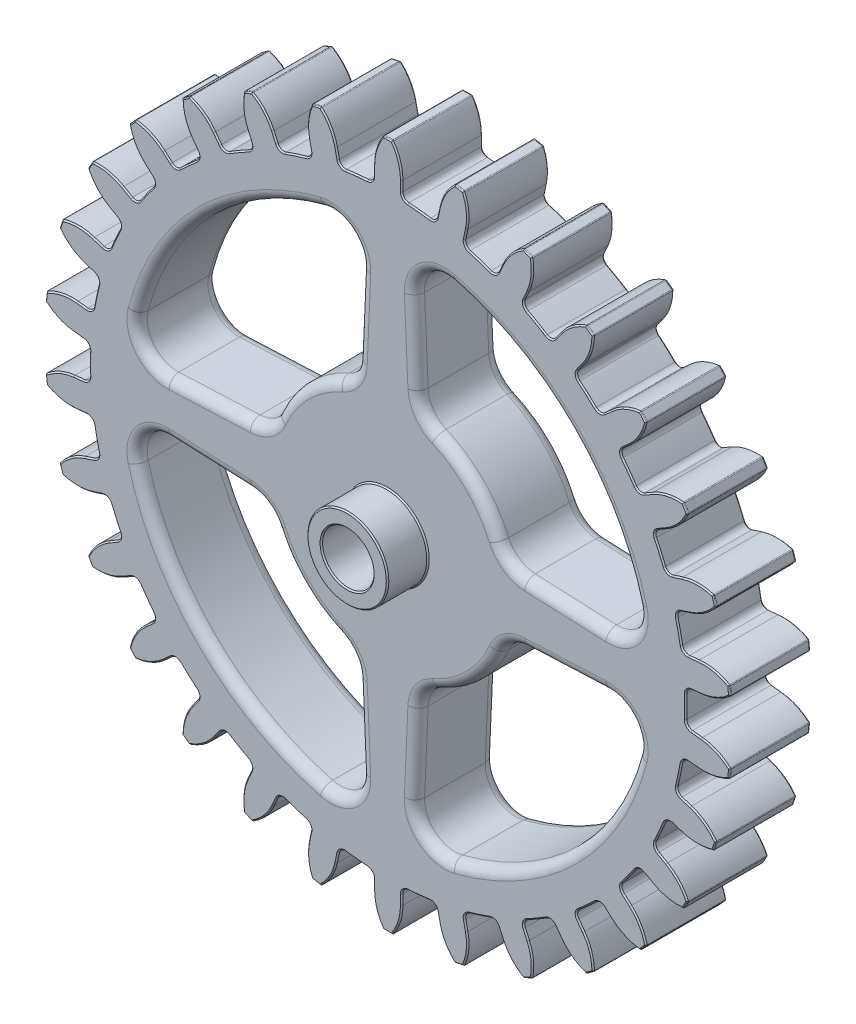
SolidWorks part; units mm, degrees
ref_plane "Спереди" through (0, 0, 0) normal (0, 0, 1) x (1, 0, 0)
ref_plane "Сверху" through (0, 0, 0) normal (0, 1, 0) x (1, 0, 0)
ref_plane "Справа" through (0, 0, 0) normal (1, 0, 0) x (0, 0, -1)
sketch "Эскиз1" plane through (0, 0, 0) normal (0, 0, 1) x (1, 0, 0)
  line L0 (0, 0) -> (0, 68) construction
  line L1 (0, 0) -> (-68, 0) construction
  line L2 (-2.8, 62.1091) -> (-2.8, 60.1324)
  line L3 (2.8, 62.1091) -> (2.8, 60.1324)
  line L4 (10.1744, 61.334) -> (9.7634, 59.4005)
  line L5 (15.652, 60.1697) -> (15.241, 58.2362)
  line L6 (22.7041, 57.8783) -> (21.9001, 56.0726)
  line L7 (27.82, 55.6006) -> (27.016, 53.7948)
  line L8 (34.2415, 51.8931) -> (33.0797, 50.2939)
  line L9 (38.772, 48.6015) -> (37.6102, 47.0024)
  line L10 (44.2825, 43.6399) -> (42.8135, 42.3172)
  line L11 (48.0296, 39.4783) -> (46.5607, 38.1556)
  line L12 (52.388, 33.4794) -> (50.6762, 32.4911)
  line L13 (55.188, 28.6297) -> (53.4762, 27.6413)
  line L14 (58.204, 21.8557) -> (56.3241, 21.2449)
  line L15 (59.9345, 16.5298) -> (58.0546, 15.919)
  line L16 (61.4761, 9.2768) -> (59.5103, 9.0702)
  line L17 (62.0615, 3.7075) -> (60.0957, 3.5009)
  line L18 (62.0615, -3.7075) -> (60.0957, -3.5009)
  line L19 (61.4761, -9.2768) -> (59.5103, -9.0702)
  line L20 (59.9345, -16.5298) -> (58.0546, -15.919)
  line L21 (58.204, -21.8557) -> (56.3241, -21.2449)
  line L22 (55.188, -28.6297) -> (53.4762, -27.6413)
  line L23 (52.388, -33.4794) -> (50.6762, -32.4911)
  line L24 (48.0296, -39.4783) -> (46.5607, -38.1556)
  line L25 (44.2825, -43.6399) -> (42.8135, -42.3172)
  line L26 (38.772, -48.6015) -> (37.6102, -47.0024)
  line L27 (34.2415, -51.8931) -> (33.0797, -50.2939)
  line L28 (27.82, -55.6006) -> (27.016, -53.7948)
  line L29 (22.7041, -57.8783) -> (21.9001, -56.0726)
  line L30 (15.652, -60.1697) -> (15.241, -58.2362)
  line L31 (10.1744, -61.334) -> (9.7634, -59.4005)
  line L32 (2.8, -62.1091) -> (2.8, -60.1324)
  line L33 (-2.8, -62.1091) -> (-2.8, -60.1324)
  line L34 (-10.1744, -61.334) -> (-9.7634, -59.4005)
  line L35 (-15.652, -60.1697) -> (-15.241, -58.2362)
  line L36 (-22.7041, -57.8783) -> (-21.9001, -56.0726)
  line L37 (-27.82, -55.6006) -> (-27.016, -53.7948)
  line L38 (-34.2415, -51.8931) -> (-33.0797, -50.2939)
  line L39 (-38.772, -48.6015) -> (-37.6102, -47.0024)
  line L40 (-44.2825, -43.6399) -> (-42.8135, -42.3172)
  line L41 (-48.0296, -39.4783) -> (-46.5607, -38.1556)
  line L42 (-52.388, -33.4794) -> (-50.6762, -32.4911)
  line L43 (-55.188, -28.6297) -> (-53.4762, -27.6413)
  line L44 (-58.204, -21.8557) -> (-56.3241, -21.2449)
  line L45 (-59.9345, -16.5298) -> (-58.0546, -15.919)
  line L46 (-61.4761, -9.2768) -> (-59.5103, -9.0702)
  line L47 (-62.0615, -3.7075) -> (-60.0957, -3.5009)
  line L48 (-62.0615, 3.7075) -> (-60.0957, 3.5009)
  line L49 (-61.4761, 9.2768) -> (-59.5103, 9.0702)
  line L50 (-59.9345, 16.5298) -> (-58.0546, 15.919)
  line L51 (-58.204, 21.8557) -> (-56.3241, 21.2449)
  line L52 (-55.188, 28.6297) -> (-53.4762, 27.6413)
  line L53 (-52.388, 33.4794) -> (-50.6762, 32.4911)
  line L54 (-48.0296, 39.4783) -> (-46.5607, 38.1556)
  line L55 (-44.2825, 43.6399) -> (-42.8135, 42.3172)
  line L56 (-38.772, 48.6015) -> (-37.6102, 47.0024)
  line L57 (-34.2415, 51.8931) -> (-33.0797, 50.2939)
  line L58 (-27.82, 55.6006) -> (-27.016, 53.7948)
  line L59 (-22.7041, 57.8783) -> (-21.9001, 56.0726)
  line L60 (-15.652, 60.1697) -> (-15.241, 58.2362)
  line L61 (-10.1744, 61.334) -> (-9.7634, 59.4005)
  line L62 (-5.3258, 43.2912) -> (-6.0273, 27.2243)
  line L63 (-43.2912, 5.3258) -> (-27.2243, 6.0273)
  line L64 (-5, 54.4793) -> (-5, 47.9664) construction
  line L65 (5.3258, 43.2912) -> (6.0273, 27.2243)
  line L66 (43.2912, 5.3258) -> (27.2243, 6.0273)
  line L67 (43.2912, -5.3258) -> (27.2243, -6.0273)
  line L68 (5.3258, -43.2912) -> (6.0273, -27.2243)
  line L69 (-5.3258, -43.2912) -> (-6.0273, -27.2243)
  line L70 (-43.2912, -5.3258) -> (-27.2243, -6.0273)
  circle A0 centre (0, 0) radius 5.1
  circle A1 centre (0, 0) radius 8 construction
  arc A2 (0.8848, 67.9942) -> (-0.8848, 67.9942) centre (0, 0) ccw
  arc A3 (-3.9842, 58.8653) -> (-8.3416, 58.4073) centre (0, 0) ccw
  circle A4 centre (0, 0) radius 62.525 construction
  arc A5 (-0.8848, 67.9942) -> (-2.8, 62.1091) centre (7.2, 62.1091) ccw
  arc A6 (0.8848, 67.9942) -> (2.8, 62.1091) centre (-7.2, 62.1091) cw
  arc A7 (2.8, 60.1324) -> (3.9842, 58.8653) centre (4.07, 60.1324) ccw
  arc A8 (-2.8, 60.1324) -> (-3.9842, 58.8653) centre (-4.07, 60.1324) cw
  arc A9 (9.7634, 59.4005) -> (8.3416, 58.4073) centre (8.5212, 59.6646) cw
  arc A10 (13.2713, 66.6924) -> (10.1744, 61.334) centre (19.9559, 59.2549) ccw
  arc A11 (15.0023, 66.3244) -> (13.2713, 66.6924) centre (0, 0) ccw
  arc A12 (15.0023, 66.3244) -> (15.652, 60.1697) centre (5.8705, 62.2488) cw
  arc A13 (15.241, 58.2362) -> (16.136, 56.7506) centre (16.4833, 57.9722) ccw
  arc A14 (21.9001, 56.0726) -> (20.3029, 55.3967) centre (20.7399, 56.5891) cw
  arc A15 (26.8474, 62.4757) -> (22.7041, 57.8783) centre (31.8396, 53.8109) ccw
  arc A16 (28.4641, 61.7559) -> (26.8474, 62.4757) centre (0, 0) ccw
  arc A17 (28.4641, 61.7559) -> (27.82, 55.6006) centre (18.6845, 59.668) cw
  arc A18 (27.016, 53.7948) -> (27.5825, 52.1556) centre (28.1762, 53.2783) ccw
  arc A19 (33.0797, 50.2939) -> (31.3769, 49.9649) centre (32.0523, 51.0404) cw
  arc A20 (39.2502, 55.5286) -> (34.2415, 51.8931) centre (42.3317, 46.0152) ccw
  arc A21 (40.6819, 54.4884) -> (39.2502, 55.5286) centre (0, 0) ccw
  arc A22 (40.6819, 54.4884) -> (38.772, 48.6015) centre (30.6819, 54.4793) cw
  arc A23 (37.6102, 47.0024) -> (37.8235, 45.2812) centre (38.6376, 46.2559) ccw
  arc A24 (42.8135, 42.3172) -> (41.0795, 42.3495) centre (41.9637, 43.261) cw
  arc A25 (49.9375, 46.1546) -> (44.2825, 43.6399) centre (50.9738, 36.2084) ccw
  arc A26 (51.1216, 44.8395) -> (49.9375, 46.1546) centre (0, 0) ccw
  arc A27 (51.1216, 44.8395) -> (48.0296, 39.4783) centre (41.3383, 46.9097) cw
  arc A28 (46.5607, 38.1556) -> (46.4114, 36.4277) centre (47.4105, 37.2118) ccw
  arc A29 (50.6762, 32.4911) -> (48.9867, 32.8831) centre (50.0412, 33.5909) cw
  arc A30 (58.4423, 34.7634) -> (52.388, 33.4794) centre (57.388, 24.8191) ccw
  arc A31 (59.3272, 33.2308) -> (58.4423, 34.7634) centre (0, 0) ccw
  arc A32 (59.3272, 33.2308) -> (55.188, 28.6297) centre (50.188, 37.2899) cw
  arc A33 (53.4762, 27.6413) -> (52.971, 25.9822) centre (54.1112, 26.5415) ccw
  arc A34 (56.3241, 21.2449) -> (54.753, 21.9796) centre (55.9316, 22.4527) cw
  arc A35 (64.3929, 21.8529) -> (58.204, 21.8557) centre (61.2942, 12.3451) ccw
  arc A36 (64.9398, 20.1698) -> (64.3929, 21.8529) centre (0, 0) ccw
  arc A37 (64.9398, 20.1698) -> (59.9345, 16.5298) centre (56.8443, 26.0404) cw
  arc A38 (58.0546, 15.919) -> (57.2154, 14.4011) centre (58.447, 14.7111) ccw
  arc A39 (59.5103, 9.0702) -> (58.1264, 10.1155) centre (59.3776, 10.3333) cw
  arc A40 (67.5293, 7.9873) -> (61.4761, 9.2768) centre (62.5214, -0.6684) ccw
  arc A41 (67.7143, 6.2273) -> (67.5293, 7.9873) centre (0, 0) ccw
  arc A42 (67.7143, 6.2273) -> (62.0615, 3.7075) centre (61.0162, 13.6527) cw
  arc A43 (60.0957, 3.5009) -> (58.9593, 2.1907) centre (60.2284, 2.2378) ccw
  arc A44 (60.0957, -3.5009) -> (58.9593, -2.1907) centre (60.2284, -2.2378) cw
  arc A45 (67.7143, -6.2273) -> (62.0615, -3.7075) centre (61.0162, -13.6527) ccw
  arc A46 (67.5293, -7.9873) -> (67.7143, -6.2273) centre (0, 0) ccw
  arc A47 (67.5293, -7.9873) -> (61.4761, -9.2768) centre (62.5214, 0.6684) cw
  arc A48 (59.5103, -9.0702) -> (58.1264, -10.1155) centre (59.3776, -10.3333) ccw
  arc A49 (58.0546, -15.919) -> (57.2154, -14.4011) centre (58.447, -14.7111) cw
  arc A50 (64.9398, -20.1698) -> (59.9345, -16.5298) centre (56.8443, -26.0404) ccw
  arc A51 (64.3929, -21.8529) -> (64.9398, -20.1698) centre (0, 0) ccw
  arc A52 (64.3929, -21.8529) -> (58.204, -21.8557) centre (61.2942, -12.3451) cw
  arc A53 (56.3241, -21.2449) -> (54.753, -21.9796) centre (55.9316, -22.4527) ccw
  arc A54 (53.4762, -27.6413) -> (52.971, -25.9822) centre (54.1112, -26.5415) cw
  arc A55 (59.3272, -33.2308) -> (55.188, -28.6297) centre (50.188, -37.2899) ccw
  arc A56 (58.4423, -34.7634) -> (59.3272, -33.2308) centre (0, 0) ccw
  arc A57 (58.4423, -34.7634) -> (52.388, -33.4794) centre (57.388, -24.8191) cw
  arc A58 (50.6762, -32.4911) -> (48.9867, -32.8831) centre (50.0412, -33.5909) ccw
  arc A59 (46.5607, -38.1556) -> (46.4114, -36.4277) centre (47.4105, -37.2118) cw
  arc A60 (51.1216, -44.8395) -> (48.0296, -39.4783) centre (41.3383, -46.9097) ccw
  arc A61 (49.9375, -46.1546) -> (51.1216, -44.8395) centre (0, 0) ccw
  arc A62 (49.9375, -46.1546) -> (44.2825, -43.6399) centre (50.9738, -36.2084) cw
  arc A63 (42.8135, -42.3172) -> (41.0795, -42.3495) centre (41.9637, -43.261) ccw
  arc A64 (37.6102, -47.0024) -> (37.8235, -45.2812) centre (38.6376, -46.2559) cw
  arc A65 (40.6819, -54.4884) -> (38.772, -48.6015) centre (30.6819, -54.4793) ccw
  arc A66 (39.2502, -55.5286) -> (40.6819, -54.4884) centre (0, 0) ccw
  arc A67 (39.2502, -55.5286) -> (34.2415, -51.8931) centre (42.3317, -46.0152) cw
  arc A68 (33.0797, -50.2939) -> (31.3769, -49.9649) centre (32.0523, -51.0404) ccw
  arc A69 (27.016, -53.7948) -> (27.5825, -52.1556) centre (28.1762, -53.2783) cw
  arc A70 (28.4641, -61.7559) -> (27.82, -55.6006) centre (18.6845, -59.668) ccw
  arc A71 (26.8474, -62.4757) -> (28.4641, -61.7559) centre (0, 0) ccw
  arc A72 (26.8474, -62.4757) -> (22.7041, -57.8783) centre (31.8396, -53.8109) cw
  arc A73 (21.9001, -56.0726) -> (20.3029, -55.3967) centre (20.7399, -56.5891) ccw
  arc A74 (15.241, -58.2362) -> (16.136, -56.7506) centre (16.4833, -57.9722) cw
  arc A75 (15.0023, -66.3244) -> (15.652, -60.1697) centre (5.8705, -62.2488) ccw
  arc A76 (13.2713, -66.6924) -> (15.0023, -66.3244) centre (0, 0) ccw
  arc A77 (13.2713, -66.6924) -> (10.1744, -61.334) centre (19.9559, -59.2549) cw
  arc A78 (9.7634, -59.4005) -> (8.3416, -58.4073) centre (8.5212, -59.6646) ccw
  arc A79 (2.8, -60.1324) -> (3.9842, -58.8653) centre (4.07, -60.1324) cw
  arc A80 (0.8848, -67.9942) -> (2.8, -62.1091) centre (-7.2, -62.1091) ccw
  arc A81 (-0.8848, -67.9942) -> (0.8848, -67.9942) centre (0, 0) ccw
  arc A82 (-0.8848, -67.9942) -> (-2.8, -62.1091) centre (7.2, -62.1091) cw
  arc A83 (-2.8, -60.1324) -> (-3.9842, -58.8653) centre (-4.07, -60.1324) ccw
  arc A84 (-9.7634, -59.4005) -> (-8.3416, -58.4073) centre (-8.5212, -59.6646) cw
  arc A85 (-13.2713, -66.6924) -> (-10.1744, -61.334) centre (-19.9559, -59.2549) ccw
  arc A86 (-15.0023, -66.3244) -> (-13.2713, -66.6924) centre (0, 0) ccw
  arc A87 (-15.0023, -66.3244) -> (-15.652, -60.1697) centre (-5.8705, -62.2488) cw
  arc A88 (-15.241, -58.2362) -> (-16.136, -56.7506) centre (-16.4833, -57.9722) ccw
  arc A89 (-21.9001, -56.0726) -> (-20.3029, -55.3967) centre (-20.7399, -56.5891) cw
  arc A90 (-26.8474, -62.4757) -> (-22.7041, -57.8783) centre (-31.8396, -53.8109) ccw
  arc A91 (-28.4641, -61.7559) -> (-26.8474, -62.4757) centre (0, 0) ccw
  arc A92 (-28.4641, -61.7559) -> (-27.82, -55.6006) centre (-18.6845, -59.668) cw
  arc A93 (-27.016, -53.7948) -> (-27.5825, -52.1556) centre (-28.1762, -53.2783) ccw
  arc A94 (-33.0797, -50.2939) -> (-31.3769, -49.9649) centre (-32.0523, -51.0404) cw
  arc A95 (-39.2502, -55.5286) -> (-34.2415, -51.8931) centre (-42.3317, -46.0152) ccw
  arc A96 (-40.6819, -54.4884) -> (-39.2502, -55.5286) centre (0, 0) ccw
  arc A97 (-40.6819, -54.4884) -> (-38.772, -48.6015) centre (-30.6819, -54.4793) cw
  arc A98 (-37.6102, -47.0024) -> (-37.8235, -45.2812) centre (-38.6376, -46.2559) ccw
  arc A99 (-42.8135, -42.3172) -> (-41.0795, -42.3495) centre (-41.9637, -43.261) cw
  arc A100 (-49.9375, -46.1546) -> (-44.2825, -43.6399) centre (-50.9738, -36.2084) ccw
  arc A101 (-51.1216, -44.8395) -> (-49.9375, -46.1546) centre (0, 0) ccw
  arc A102 (-51.1216, -44.8395) -> (-48.0296, -39.4783) centre (-41.3383, -46.9097) cw
  arc A103 (-46.5607, -38.1556) -> (-46.4114, -36.4277) centre (-47.4105, -37.2118) ccw
  arc A104 (-50.6762, -32.4911) -> (-48.9867, -32.8831) centre (-50.0412, -33.5909) cw
  arc A105 (-58.4423, -34.7634) -> (-52.388, -33.4794) centre (-57.388, -24.8191) ccw
  arc A106 (-59.3272, -33.2308) -> (-58.4423, -34.7634) centre (0, 0) ccw
  arc A107 (-59.3272, -33.2308) -> (-55.188, -28.6297) centre (-50.188, -37.2899) cw
  arc A108 (-53.4762, -27.6413) -> (-52.971, -25.9822) centre (-54.1112, -26.5415) ccw
  arc A109 (-56.3241, -21.2449) -> (-54.753, -21.9796) centre (-55.9316, -22.4527) cw
  arc A110 (-64.3929, -21.8529) -> (-58.204, -21.8557) centre (-61.2942, -12.3451) ccw
  arc A111 (-64.9398, -20.1698) -> (-64.3929, -21.8529) centre (0, 0) ccw
  arc A112 (-64.9398, -20.1698) -> (-59.9345, -16.5298) centre (-56.8443, -26.0404) cw
  arc A113 (-58.0546, -15.919) -> (-57.2154, -14.4011) centre (-58.447, -14.7111) ccw
  arc A114 (-59.5103, -9.0702) -> (-58.1264, -10.1155) centre (-59.3776, -10.3333) cw
  arc A115 (-67.5293, -7.9873) -> (-61.4761, -9.2768) centre (-62.5214, 0.6684) ccw
  arc A116 (-67.7143, -6.2273) -> (-67.5293, -7.9873) centre (0, 0) ccw
  arc A117 (-67.7143, -6.2273) -> (-62.0615, -3.7075) centre (-61.0162, -13.6527) cw
  arc A118 (-60.0957, -3.5009) -> (-58.9593, -2.1907) centre (-60.2284, -2.2378) ccw
  arc A119 (-60.0957, 3.5009) -> (-58.9593, 2.1907) centre (-60.2284, 2.2378) cw
  arc A120 (-67.7143, 6.2273) -> (-62.0615, 3.7075) centre (-61.0162, 13.6527) ccw
  arc A121 (-67.5293, 7.9873) -> (-67.7143, 6.2273) centre (0, 0) ccw
  arc A122 (-67.5293, 7.9873) -> (-61.4761, 9.2768) centre (-62.5214, -0.6684) cw
  arc A123 (-59.5103, 9.0702) -> (-58.1264, 10.1155) centre (-59.3776, 10.3333) ccw
  arc A124 (-58.0546, 15.919) -> (-57.2154, 14.4011) centre (-58.447, 14.7111) cw
  arc A125 (-64.9398, 20.1698) -> (-59.9345, 16.5298) centre (-56.8443, 26.0404) ccw
  arc A126 (-64.3929, 21.8529) -> (-64.9398, 20.1698) centre (0, 0) ccw
  arc A127 (-64.3929, 21.8529) -> (-58.204, 21.8557) centre (-61.2942, 12.3451) cw
  arc A128 (-56.3241, 21.2449) -> (-54.753, 21.9796) centre (-55.9316, 22.4527) ccw
  arc A129 (-53.4762, 27.6413) -> (-52.971, 25.9822) centre (-54.1112, 26.5415) cw
  arc A130 (-59.3272, 33.2308) -> (-55.188, 28.6297) centre (-50.188, 37.2899) ccw
  arc A131 (-58.4423, 34.7634) -> (-59.3272, 33.2308) centre (0, 0) ccw
  arc A132 (-58.4423, 34.7634) -> (-52.388, 33.4794) centre (-57.388, 24.8191) cw
  arc A133 (-50.6762, 32.4911) -> (-48.9867, 32.8831) centre (-50.0412, 33.5909) ccw
  arc A134 (-46.5607, 38.1556) -> (-46.4114, 36.4277) centre (-47.4105, 37.2118) cw
  arc A135 (-51.1216, 44.8395) -> (-48.0296, 39.4783) centre (-41.3383, 46.9097) ccw
  arc A136 (-49.9375, 46.1546) -> (-51.1216, 44.8395) centre (0, 0) ccw
  arc A137 (-49.9375, 46.1546) -> (-44.2825, 43.6399) centre (-50.9738, 36.2084) cw
  arc A138 (-42.8135, 42.3172) -> (-41.0795, 42.3495) centre (-41.9637, 43.261) ccw
  arc A139 (-37.6102, 47.0024) -> (-37.8235, 45.2812) centre (-38.6376, 46.2559) cw
  arc A140 (-40.6819, 54.4884) -> (-38.772, 48.6015) centre (-30.6819, 54.4793) ccw
  arc A141 (-39.2502, 55.5286) -> (-40.6819, 54.4884) centre (0, 0) ccw
  arc A142 (-39.2502, 55.5286) -> (-34.2415, 51.8931) centre (-42.3317, 46.0152) cw
  arc A143 (-33.0797, 50.2939) -> (-31.3769, 49.9649) centre (-32.0523, 51.0404) ccw
  arc A144 (-27.016, 53.7948) -> (-27.5825, 52.1556) centre (-28.1762, 53.2783) cw
  arc A145 (-28.4641, 61.7559) -> (-27.82, 55.6006) centre (-18.6845, 59.668) ccw
  arc A146 (-26.8474, 62.4757) -> (-28.4641, 61.7559) centre (0, 0) ccw
  arc A147 (-26.8474, 62.4757) -> (-22.7041, 57.8783) centre (-31.8396, 53.8109) cw
  arc A148 (-21.9001, 56.0726) -> (-20.3029, 55.3967) centre (-20.7399, 56.5891) ccw
  arc A149 (-15.241, 58.2362) -> (-16.136, 56.7506) centre (-16.4833, 57.9722) cw
  arc A150 (-15.0023, 66.3244) -> (-15.652, 60.1697) centre (-5.8705, 62.2488) ccw
  arc A151 (-13.2713, 66.6924) -> (-15.0023, 66.3244) centre (0, 0) ccw
  arc A152 (-13.2713, 66.6924) -> (-10.1744, 61.334) centre (-19.9559, 59.2549) cw
  arc A153 (-9.7634, 59.4005) -> (-8.3416, 58.4073) centre (-8.5212, 59.6646) ccw
  arc A154 (-16.136, 56.7506) -> (-20.3029, 55.3967) centre (0, 0) ccw
  arc A155 (-27.5825, 52.1556) -> (-31.3769, 49.9649) centre (0, 0) ccw
  arc A156 (8.3416, 58.4073) -> (3.9842, 58.8653) centre (0, 0) ccw
  arc A157 (20.3029, 55.3967) -> (16.136, 56.7506) centre (0, 0) ccw
  arc A158 (31.3769, 49.9649) -> (27.5825, 52.1556) centre (0, 0) ccw
  arc A159 (41.0795, 42.3495) -> (37.8235, 45.2812) centre (0, 0) ccw
  arc A160 (-37.8235, 45.2812) -> (-41.0795, 42.3495) centre (0, 0) ccw
  arc A161 (-46.4114, 36.4277) -> (-48.9867, 32.8831) centre (0, 0) ccw
  arc A162 (-52.971, 25.9822) -> (-54.753, 21.9796) centre (0, 0) ccw
  arc A163 (-57.2154, 14.4011) -> (-58.1264, 10.1155) centre (0, 0) ccw
  arc A164 (-58.9593, 2.1907) -> (-58.9593, -2.1907) centre (0, 0) ccw
  arc A165 (48.9867, 32.8831) -> (46.4114, 36.4277) centre (0, 0) ccw
  arc A166 (54.753, 21.9796) -> (52.971, 25.9822) centre (0, 0) ccw
  arc A167 (58.1264, 10.1155) -> (57.2154, 14.4011) centre (0, 0) ccw
  arc A168 (58.9593, -2.1907) -> (58.9593, 2.1907) centre (0, 0) ccw
  arc A169 (57.2154, -14.4011) -> (58.1264, -10.1155) centre (0, 0) ccw
  arc A170 (52.971, -25.9822) -> (54.753, -21.9796) centre (0, 0) ccw
  arc A171 (46.4114, -36.4277) -> (48.9867, -32.8831) centre (0, 0) ccw
  arc A172 (37.8235, -45.2812) -> (41.0795, -42.3495) centre (0, 0) ccw
  arc A173 (27.5825, -52.1556) -> (31.3769, -49.9649) centre (0, 0) ccw
  arc A174 (16.136, -56.7506) -> (20.3029, -55.3967) centre (0, 0) ccw
  arc A175 (3.9842, -58.8653) -> (8.3416, -58.4073) centre (0, 0) ccw
  arc A176 (-8.3416, -58.4073) -> (-3.9842, -58.8653) centre (0, 0) ccw
  arc A177 (-20.3029, -55.3967) -> (-16.136, -56.7506) centre (0, 0) ccw
  arc A178 (-58.1264, -10.1155) -> (-57.2154, -14.4011) centre (0, 0) ccw
  arc A179 (-54.753, -21.9796) -> (-52.971, -25.9822) centre (0, 0) ccw
  arc A180 (-48.9867, -32.8831) -> (-46.4114, -36.4277) centre (0, 0) ccw
  arc A181 (-41.0795, -42.3495) -> (-37.8235, -45.2812) centre (0, 0) ccw
  arc A182 (-31.3769, -49.9649) -> (-27.5825, -52.1556) centre (0, 0) ccw
  arc A183 (-9.6173, 21.9888) -> (-21.9888, 9.6173) centre (0, 0) ccw
  arc A184 (-12.8295, 49.3599) -> (-49.3599, 12.8295) centre (0, 0) ccw
  arc A185 (-5.3258, 43.2912) -> (-12.8295, 49.3599) centre (-11.3201, 43.5529) ccw
  arc A186 (-6.0273, 27.2243) -> (-9.6173, 21.9888) centre (-12.0216, 27.486) cw
  arc A187 (-27.2243, 6.0273) -> (-21.9888, 9.6173) centre (-27.486, 12.0216) ccw
  arc A188 (-43.2912, 5.3258) -> (-49.3599, 12.8295) centre (-43.5529, 11.3201) cw
  arc A189 (21.9888, 9.6173) -> (9.6173, 21.9888) centre (0, 0) ccw
  arc A190 (27.2243, 6.0273) -> (21.9888, 9.6173) centre (27.486, 12.0216) cw
  arc A191 (6.0273, 27.2243) -> (9.6173, 21.9888) centre (12.0216, 27.486) ccw
  arc A192 (43.2912, 5.3258) -> (49.3599, 12.8295) centre (43.5529, 11.3201) ccw
  arc A193 (5.3258, 43.2912) -> (12.8295, 49.3599) centre (11.3201, 43.5529) cw
  arc A194 (49.3599, 12.8295) -> (12.8295, 49.3599) centre (0, 0) ccw
  arc A195 (9.6173, -21.9888) -> (21.9888, -9.6173) centre (0, 0) ccw
  arc A196 (6.0273, -27.2243) -> (9.6173, -21.9888) centre (12.0216, -27.486) cw
  arc A197 (27.2243, -6.0273) -> (21.9888, -9.6173) centre (27.486, -12.0216) ccw
  arc A198 (5.3258, -43.2912) -> (12.8295, -49.3599) centre (11.3201, -43.5529) ccw
  arc A199 (43.2912, -5.3258) -> (49.3599, -12.8295) centre (43.5529, -11.3201) cw
  arc A200 (12.8295, -49.3599) -> (49.3599, -12.8295) centre (0, 0) ccw
  arc A201 (-21.9888, -9.6173) -> (-9.6173, -21.9888) centre (0, 0) ccw
  arc A202 (-27.2243, -6.0273) -> (-21.9888, -9.6173) centre (-27.486, -12.0216) cw
  arc A203 (-6.0273, -27.2243) -> (-9.6173, -21.9888) centre (-12.0216, -27.486) ccw
  arc A204 (-43.2912, -5.3258) -> (-49.3599, -12.8295) centre (-43.5529, -11.3201) ccw
  arc A205 (-5.3258, -43.2912) -> (-12.8295, -49.3599) centre (-11.3201, -43.5529) cw
  arc A206 (-49.3599, -12.8295) -> (-12.8295, -49.3599) centre (0, 0) ccw
  point P17 (2.8, 58.9335)
  point P20 (-2.8, 58.9335)
  point P406 (-5, 50.7543)
  dimension "D1" = 10.2
  dimension "D2" = 16
  dimension "D3" = 136
  dimension "D4" = 125.05
  dimension "D5" = 118
  dimension "D7" = 20
  dimension "D8" = 1.27
  dimension "D10" = 48
  dimension "D11" = 102
  dimension "D15" = 6
  dimension "D6" = 5.6
  dimension "D12" = 2.5
  dimension "D13" = 2.5
  dimension "D14" = 5
  dimension "D9" = 30
  dimension "D16" = 4
extrude "Бобышка-Вытянуть1" add sketch "Эскиз1" along normal blind 16
sketch "Эскиз2" plane through (0, 0, 16) normal (0, 0, 1) x (1, 0, 0)
  circle A0 centre (0, 0) radius 8 construction
  circle A1 centre (0, 0) radius 8
  circle A2 centre (0, 0) radius 5.1 construction
  circle A3 centre (0, 0) radius 5.1
extrude "Бобышка-Вытянуть2" add sketch "Эскиз2" along normal blind 8
fillet "Скругление1" radius 2 64 edges at (7.5471, -48.2181, 16) (5.6766, -35.2577, 16) (7.0732, -24.0929, 16) (16.9706, -16.9706, 16) (24.0929, -7.0732, 16) (35.2577, -5.6766, 16) (48.2181, -7.5471, 16) (7.5471, -48.2181, 0) (5.6766, -35.2577, 0) (7.0732, -24.0929, 0) (16.9706, -16.9706, 0) (24.0929, -7.0732, 0) (35.2577, -5.6766, 0) (48.2181, -7.5471, 0) (-48.2181, -7.5471, 16) (-35.2577, -5.6766, 16) (-24.0929, -7.0732, 16) (-16.9706, -16.9706, 16) (-7.0732, -24.0929, 16) (-5.6766, -35.2577, 16) (-7.5471, -48.2181, 16) (-48.2181, -7.5471, 0) (-35.2577, -5.6766, 0) (-24.0929, -7.0732, 0) (-16.9706, -16.9706, 0) (-7.0732, -24.0929, 0) (-5.6766, -35.2577, 0) (-7.5471, -48.2181, 0) (-48.2181, 7.5471, 16) (-36.0624, 36.0624, 16) (-7.5471, 48.2181, 16) (-5.6766, 35.2577, 16) (-7.0732, 24.0929, 16) (-16.9706, 16.9706, 16) (-24.0929, 7.0732, 16) (-48.2181, 7.5471, 0) (-36.0624, 36.0624, 0) (-7.5471, 48.2181, 0) (-5.6766, 35.2577, 0) (-7.0732, 24.0929, 0) (-16.9706, 16.9706, 0) (-24.0929, 7.0732, 0) (7.0732, 24.0929, 16) (5.6766, 35.2577, 16) (7.5471, 48.2181, 16) (36.0624, 36.0624, 16) (48.2181, 7.5471, 16) (35.2577, 5.6766, 16) (24.0929, 7.0732, 16) (7.0732, 24.0929, 0) (5.6766, 35.2577, 0) (7.5471, 48.2181, 0) (36.0624, 36.0624, 0) (48.2181, 7.5471, 0) (35.2577, 5.6766, 0) (24.0929, 7.0732, 0) (36.0624, -36.0624, 16) (36.0624, -36.0624, 0) (-36.0624, -36.0624, 16) (-36.0624, -36.0624, 0) (-35.2577, 5.6766, 16) (-35.2577, 5.6766, 0) (16.9706, 16.9706, 16) (16.9706, 16.9706, 0)
chamfer "Фаска1" distance 0.25 angle 45 400 edges at (5.1, 0, 0) (2.8, 61.1207, 0) (2.3092, 65.2035, 0) (0, 68, 0) (-2.3092, 65.2035, 0) (-2.8, 61.1207, 0) (-3.1421, 59.2652, 0) (-6.1672, 58.6768, 0) (-9.2485, 58.6234, 0) (-9.9689, 60.3673, 0) (-11.2979, 64.2588, 0) (-14.138, 66.514, 0) (-15.8153, 63.2986, 0) (-15.4465, 59.203, 0) (-15.3954, 57.3169, 0) (-18.232, 56.1123, 0) (-21.2349, 55.4195, 0) (-22.3021, 56.9754, 0) (-24.4111, 60.5056, 0) (-27.6581, 62.1211, 0) (-28.6302, 58.6272, 0) (-27.418, 54.6977, 0) (-26.9758, 52.8635, 0) (-29.5, 51.0955, 0) (-32.2932, 49.7935, 0) (-33.6606, 51.0935, 0) (-36.4575, 54.1081, 0) (-39.9694, 55.0132, 0) (-40.1938, 51.3935, 0) (-38.1911, 47.8019, 0) (-37.3773, 46.0997, 0) (-39.4787, 43.8455, 0) (-41.9402, 41.9913, 0) (-43.548, 42.9786, 0) (-46.9105, 45.3457, 0) (-50.5338, 45.5009, 0) (-50.0008, 41.9136, 0) (-47.2951, 38.817, 0) (-46.1452, 37.3211, 0) (-47.732, 34.6793, 0) (-49.7541, 32.3538, 0) (-51.5321, 32.9852, 0) (-55.3133, 34.6016, 0) (-58.8897, 34, 0) (-57.6225, 30.602, 0) (-54.3321, 28.1355, 0) (-52.8963, 26.9114, 0) (-53.8992, 23.9975, 0) (-55.3936, 21.3023, 0) (-57.264, 21.5503, 0) (-61.2987, 22.3451, 0) (-64.6718, 21.0132, 0) (-62.7258, 17.9529, 0) (-58.9945, 16.2244, 0) (-57.3356, 15.3256, 0) (-57.7107, 12.2668, 0) (-58.6121, 9.3198, 0) (-60.4932, 9.1735, 0) (-64.605, 9.1121, 0) (-67.6275, 7.1079, 0) (-65.0877, 4.5191, 0) (-61.0786, 3.6042, 0) (-59.269, 3.07, 0) (-59, 0, 0) (-59.269, -3.07, 0) (-61.0786, -3.6042, 0) (-65.0877, -4.5191, 0) (-67.6275, -7.1079, 0) (-64.605, -9.1121, 0) (-60.4932, -9.1735, 0) (-58.6121, -9.3198, 0) (-57.7107, -12.2668, 0) (-57.3356, -15.3256, 0) (-58.9945, -16.2244, 0) (-62.7258, -17.9529, 0) (-64.6718, -21.0132, 0) (-61.2987, -22.3451, 0) (-57.264, -21.5503, 0) (-55.3936, -21.3023, 0) (-53.8992, -23.9975, 0) (-52.8963, -26.9114, 0) (-54.3321, -28.1355, 0) (-57.6225, -30.602, 0) (-58.8897, -34, 0) (-55.3133, -34.6016, 0) (-51.5321, -32.9852, 0) (-49.7541, -32.3538, 0) (-47.732, -34.6793, 0) (-46.1452, -37.3211, 0) (-47.2951, -38.817, 0) (-50.0008, -41.9136, 0) (-50.5338, -45.5009, 0) (-46.9105, -45.3457, 0) (-43.548, -42.9786, 0) (-41.9402, -41.9913, 0) (-39.4787, -43.8455, 0) (-37.3773, -46.0997, 0) (-38.1911, -47.8019, 0) (-40.1938, -51.3935, 0) (-39.9694, -55.0132, 0) (-36.4575, -54.1081, 0) (-33.6606, -51.0935, 0) (-32.2932, -49.7935, 0) (-29.5, -51.0955, 0) (-26.9758, -52.8635, 0) (-27.418, -54.6977, 0) (-28.6302, -58.6272, 0) (-27.6581, -62.1211, 0) (-24.4111, -60.5056, 0) (-22.3021, -56.9754, 0) (-21.2349, -55.4195, 0) (-18.232, -56.1123, 0) (-15.3954, -57.3169, 0) (-15.4465, -59.203, 0) (-15.8153, -63.2986, 0) (-14.138, -66.514, 0) (-11.2979, -64.2588, 0) (-9.9689, -60.3673, 0) (-9.2485, -58.6234, 0) (-6.1672, -58.6768, 0) (-3.1421, -59.2652, 0) (-2.8, -61.1207, 0) (-2.3092, -65.2035, 0) (0, -68, 0) (2.3092, -65.2035, 0) (2.8, -61.1207, 0) (3.1421, -59.2652, 0) (6.1672, -58.6768, 0) (9.2485, -58.6234, 0) (9.9689, -60.3673, 0) (11.2979, -64.2588, 0) (14.138, -66.514, 0) (15.8153, -63.2986, 0) (15.4465, -59.203, 0) (15.3954, -57.3169, 0) (18.232, -56.1123, 0) (21.2349, -55.4195, 0) (22.3021, -56.9754, 0) (24.4111, -60.5056, 0) (27.6581, -62.1211, 0) (28.6302, -58.6272, 0) (27.418, -54.6977, 0) (26.9758, -52.8635, 0) (29.5, -51.0955, 0) (32.2932, -49.7935, 0) (33.6606, -51.0935, 0) (36.4575, -54.1081, 0) (39.9694, -55.0132, 0) (40.1938, -51.3935, 0) (38.1911, -47.8019, 0) (37.3773, -46.0997, 0) (39.4787, -43.8455, 0) (41.9402, -41.9913, 0) (43.548, -42.9786, 0) (46.9105, -45.3457, 0) (50.5338, -45.5009, 0) (50.0008, -41.9136, 0) (47.2951, -38.817, 0) (46.1452, -37.3211, 0) (47.732, -34.6793, 0) (49.7541, -32.3538, 0) (51.5321, -32.9852, 0) (55.3133, -34.6016, 0) (58.8897, -34, 0) (57.6225, -30.602, 0) (54.3321, -28.1355, 0) (52.8963, -26.9114, 0) (53.8992, -23.9975, 0) (55.3936, -21.3023, 0) (57.264, -21.5503, 0) (61.2987, -22.3451, 0) (64.6718, -21.0132, 0) (62.7258, -17.9529, 0) (58.9945, -16.2244, 0) (57.3356, -15.3256, 0) (57.7107, -12.2668, 0) (58.6121, -9.3198, 0) (60.4932, -9.1735, 0) (64.605, -9.1121, 0) (67.6275, -7.1079, 0) (65.0877, -4.5191, 0) (61.0786, -3.6042, 0) (59.269, -3.07, 0) (59, 0, 0) (59.269, 3.07, 0) (61.0786, 3.6042, 0) (65.0877, 4.5191, 0) (67.6275, 7.1079, 0) (64.605, 9.1121, 0) (60.4932, 9.1735, 0) (58.6121, 9.3198, 0) (57.7107, 12.2668, 0) (57.3356, 15.3256, 0) (58.9945, 16.2244, 0) (62.7258, 17.9529, 0) (64.6718, 21.0132, 0) (61.2987, 22.3451, 0) (57.264, 21.5503, 0) (55.3936, 21.3023, 0) (53.8992, 23.9975, 0) (52.8963, 26.9114, 0) (54.3321, 28.1355, 0) (57.6225, 30.602, 0) (58.8897, 34, 0) (55.3133, 34.6016, 0) (51.5321, 32.9852, 0) (49.7541, 32.3538, 0) (47.732, 34.6793, 0) (46.1452, 37.3211, 0) (47.2951, 38.817, 0) (50.0008, 41.9136, 0) (50.5338, 45.5009, 0) (46.9105, 45.3457, 0) (43.548, 42.9786, 0) (41.9402, 41.9913, 0) (39.4787, 43.8455, 0) (37.3773, 46.0997, 0) (38.1911, 47.8019, 0) (40.1938, 51.3935, 0) (39.9694, 55.0132, 0) (36.4575, 54.1081, 0) (33.6606, 51.0935, 0) (32.2932, 49.7935, 0) (29.5, 51.0955, 0) (26.9758, 52.8635, 0) (27.418, 54.6977, 0) (28.6302, 58.6272, 0) (27.6581, 62.1211, 0) (24.4111, 60.5056, 0) (22.3021, 56.9754, 0) (21.2349, 55.4195, 0) (18.232, 56.1123, 0) (15.3954, 57.3169, 0) (15.4465, 59.203, 0) (15.8153, 63.2986, 0) (14.138, 66.514, 0) (11.2979, 64.2588, 0) (9.9689, 60.3673, 0) (9.2485, 58.6234, 0) (6.1672, 58.6768, 0) (3.1421, 59.2652, 0) (8, 0, 16) (6.1672, 58.6768, 16) (9.2485, 58.6234, 16) (9.9689, 60.3673, 16) (11.2979, 64.2588, 16) (14.138, 66.514, 16) (15.8153, 63.2986, 16) (15.4465, 59.203, 16) (15.3954, 57.3169, 16) (18.232, 56.1123, 16) (21.2349, 55.4195, 16) (22.3021, 56.9754, 16) (24.4111, 60.5056, 16) (27.6581, 62.1211, 16) (28.6302, 58.6272, 16) (27.418, 54.6977, 16) (26.9758, 52.8635, 16) (29.5, 51.0955, 16) (32.2932, 49.7935, 16) (33.6606, 51.0935, 16) (36.4575, 54.1081, 16) (39.9694, 55.0132, 16) (40.1938, 51.3935, 16) (38.1911, 47.8019, 16) (37.3773, 46.0997, 16) (39.4787, 43.8455, 16) (41.9402, 41.9913, 16) (43.548, 42.9786, 16) (46.9105, 45.3457, 16) (50.5338, 45.5009, 16) (50.0008, 41.9136, 16) (47.2951, 38.817, 16) (46.1452, 37.3211, 16) (47.732, 34.6793, 16) (49.7541, 32.3538, 16) (51.5321, 32.9852, 16) (55.3133, 34.6016, 16) (58.8897, 34, 16) (57.6225, 30.602, 16) (54.3321, 28.1355, 16) (52.8963, 26.9114, 16) (53.8992, 23.9975, 16) (55.3936, 21.3023, 16) (57.264, 21.5503, 16) (61.2987, 22.3451, 16) (64.6718, 21.0132, 16) (62.7258, 17.9529, 16) (58.9945, 16.2244, 16) (57.3356, 15.3256, 16) (57.7107, 12.2668, 16) (58.6121, 9.3198, 16) (60.4932, 9.1735, 16) (64.605, 9.1121, 16) (67.6275, 7.1079, 16) (65.0877, 4.5191, 16) (61.0786, 3.6042, 16) (59.269, 3.07, 16) (59, 0, 16) (59.269, -3.07, 16) (61.0786, -3.6042, 16) (65.0877, -4.5191, 16) (67.6275, -7.1079, 16) (64.605, -9.1121, 16) (60.4932, -9.1735, 16) (58.6121, -9.3198, 16) (57.7107, -12.2668, 16) (57.3356, -15.3256, 16) (58.9945, -16.2244, 16) (62.7258, -17.9529, 16) (64.6718, -21.0132, 16) (61.2987, -22.3451, 16) (57.264, -21.5503, 16) (55.3936, -21.3023, 16) (53.8992, -23.9975, 16) (52.8963, -26.9114, 16) (54.3321, -28.1355, 16) (57.6225, -30.602, 16) (58.8897, -34, 16) (55.3133, -34.6016, 16) (51.5321, -32.9852, 16) (49.7541, -32.3538, 16) (47.732, -34.6793, 16) (46.1452, -37.3211, 16) (47.2951, -38.817, 16) (50.0008, -41.9136, 16) (50.5338, -45.5009, 16) (46.9105, -45.3457, 16) (43.548, -42.9786, 16) (41.9402, -41.9913, 16) (39.4787, -43.8455, 16) (37.3773, -46.0997, 16) (38.1911, -47.8019, 16) (40.1938, -51.3935, 16) (39.9694, -55.0132, 16) (36.4575, -54.1081, 16) (33.6606, -51.0935, 16) (32.2932, -49.7935, 16) (29.5, -51.0955, 16) (26.9758, -52.8635, 16) (27.418, -54.6977, 16) (28.6302, -58.6272, 16) (27.6581, -62.1211, 16) (24.4111, -60.5056, 16) (22.3021, -56.9754, 16) (21.2349, -55.4195, 16) (18.232, -56.1123, 16) (15.3954, -57.3169, 16) (15.4465, -59.203, 16) (15.8153, -63.2986, 16) (14.138, -66.514, 16) (11.2979, -64.2588, 16) (9.9689, -60.3673, 16) (9.2485, -58.6234, 16) (6.1672, -58.6768, 16) (3.1421, -59.2652, 16) (2.8, -61.1207, 16) (2.3092, -65.2035, 16) (0, -68, 16) (-2.3092, -65.2035, 16) (-2.8, -61.1207, 16) (-3.1421, -59.2652, 16) (-6.1672, -58.6768, 16) (-9.2485, -58.6234, 16) (-9.9689, -60.3673, 16) (-11.2979, -64.2588, 16) (-14.138, -66.514, 16) (-15.8153, -63.2986, 16) (-15.4465, -59.203, 16) (-15.3954, -57.3169, 16) (-18.232, -56.1123, 16) (-21.2349, -55.4195, 16) (-22.3021, -56.9754, 16) (-24.4111, -60.5056, 16) (-27.6581, -62.1211, 16) (-28.6302, -58.6272, 16) (-27.418, -54.6977, 16) (-26.9758, -52.8635, 16) (-29.5, -51.0955, 16) (-32.2932, -49.7935, 16) (-33.6606, -51.0935, 16) (-36.4575, -54.1081, 16) (-39.9694, -55.0132, 16) (-40.1938, -51.3935, 16) (-38.1911, -47.8019, 16) (-37.3773, -46.0997, 16) (-39.4787, -43.8455, 16) (-41.9402, -41.9913, 16) (-43.548, -42.9786, 16) (-46.9105, -45.3457, 16) (-50.5338, -45.5009, 16) (-50.0008, -41.9136, 16) (-47.2951, -38.817, 16) (-46.1452, -37.3211, 16) (-47.732, -34.6793, 16) (-49.7541, -32.3538, 16) (-51.5321, -32.9852, 16) (-55.3133, -34.6016, 16) (-58.8897, -34, 16) (-57.6225, -30.602, 16)
fillet "Скругление2" radius 0.25 120 edges at (67.6275, -7.1079, 15.75) (67.7143, -6.2273, 8) (67.6275, -7.1079, 0.25) (67.5293, -7.9873, 8) (64.6718, -21.0132, 15.75) (64.9398, -20.1698, 8) (64.6718, -21.0132, 0.25) (64.3929, -21.8529, 8) (58.8897, -34, 15.75) (59.3272, -33.2308, 8) (58.8897, -34, 0.25) (58.4423, -34.7634, 8) (50.5338, -45.5009, 15.75) (51.1216, -44.8395, 8) (50.5338, -45.5009, 0.25) (49.9375, -46.1546, 8) (39.9694, -55.0132, 15.75) (40.6819, -54.4884, 8) (39.9694, -55.0132, 0.25) (39.2502, -55.5286, 8) (27.6581, -62.1211, 15.75) (28.4641, -61.7559, 8) (27.6581, -62.1211, 0.25) (26.8474, -62.4757, 8) (14.138, -66.514, 15.75) (15.0023, -66.3244, 8) (14.138, -66.514, 0.25) (13.2713, -66.6924, 8) (0, -68, 15.75) (0.8848, -67.9942, 8) (0, -68, 0.25) (-0.8848, -67.9942, 8) (-14.138, -66.514, 15.75) (-13.2713, -66.6924, 8) (-14.138, -66.514, 0.25) (-15.0023, -66.3244, 8) (-27.6581, -62.1211, 15.75) (-26.8474, -62.4757, 8) (-27.6581, -62.1211, 0.25) (-28.4641, -61.7559, 8) (-39.9694, -55.0132, 15.75) (-39.2502, -55.5286, 8) (-39.9694, -55.0132, 0.25) (-40.6819, -54.4884, 8) (-50.5338, -45.5009, 15.75) (-49.9375, -46.1546, 8) (-50.5338, -45.5009, 0.25) (-51.1216, -44.8395, 8) (-58.8897, -34, 15.75) (-58.4423, -34.7634, 8) (-58.8897, -34, 0.25) (-59.3272, -33.2308, 8) (-64.6718, -21.0132, 15.75) (-64.3929, -21.8529, 8) (-64.6718, -21.0132, 0.25) (-64.9398, -20.1698, 8) (-67.6275, -7.1079, 15.75) (-67.5293, -7.9873, 8) (-67.6275, -7.1079, 0.25) (-67.7143, -6.2273, 8) (-67.6275, 7.1079, 15.75) (-67.7143, 6.2273, 8) (-67.6275, 7.1079, 0.25) (-67.5293, 7.9873, 8) (-64.6718, 21.0132, 15.75) (-64.9398, 20.1698, 8) (-64.6718, 21.0132, 0.25) (-64.3929, 21.8529, 8) (-58.8897, 34, 15.75) (-59.3272, 33.2308, 8) (-58.8897, 34, 0.25) (-58.4423, 34.7634, 8) (-50.5338, 45.5009, 15.75) (-51.1216, 44.8395, 8) (-50.5338, 45.5009, 0.25) (-49.9375, 46.1546, 8) (67.6275, 7.1079, 15.75) (67.5293, 7.9873, 8) (67.6275, 7.1079, 0.25) (67.7143, 6.2273, 8) (64.6718, 21.0132, 15.75) (64.3929, 21.8529, 8) (64.6718, 21.0132, 0.25) (64.9398, 20.1698, 8) (58.8897, 34, 15.75) (58.4423, 34.7634, 8) (58.8897, 34, 0.25) (59.3272, 33.2308, 8) (50.5338, 45.5009, 15.75) (49.9375, 46.1546, 8) (50.5338, 45.5009, 0.25) (51.1216, 44.8395, 8) (39.9694, 55.0132, 15.75) (39.2502, 55.5286, 8) (39.9694, 55.0132, 0.25) (40.6819, 54.4884, 8) (27.6581, 62.1211, 15.75) (26.8474, 62.4757, 8) (27.6581, 62.1211, 0.25) (28.4641, 61.7559, 8) (14.138, 66.514, 15.75) (13.2713, 66.6924, 8) (14.138, 66.514, 0.25) (15.0023, 66.3244, 8) (0, 68, 15.75) (-0.8848, 67.9942, 8) (0, 68, 0.25) (0.8848, 67.9942, 8) (-14.138, 66.514, 15.75) (-15.0023, 66.3244, 8) (-14.138, 66.514, 0.25) (-13.2713, 66.6924, 8) (-39.9694, 55.0132, 15.75) (-40.6819, 54.4884, 8) (-39.9694, 55.0132, 0.25) (-39.2502, 55.5286, 8) (-27.6581, 62.1211, 15.75) (-28.4641, 61.7559, 8) (-27.6581, 62.1211, 0.25) (-26.8474, 62.4757, 8)
